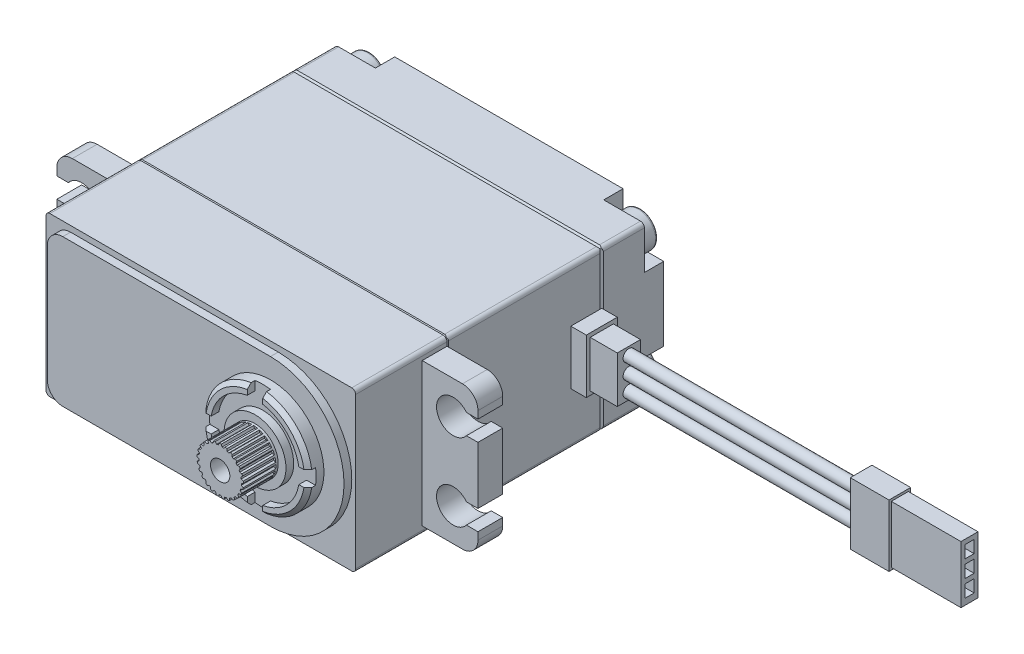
SolidWorks part; units mm, degrees
ref_plane "前视基准面" through (0, 0, 0) normal (0, 0, 1) x (1, 0, 0)
ref_plane "上视基准面" through (0, 0, 0) normal (0, 1, 0) x (1, 0, 0)
ref_plane "右视基准面" through (0, 0, 0) normal (1, 0, 0) x (0, 0, -1)
sketch "草图1" plane through (0, 0, 0) normal (0, 0, 1) x (1, 0, 0)
  line L1 (-20, 10.25) -> (20, 10.25)
  line L2 (-20, 10.25) -> (-20, -10.25)
  line L3 (-20, -10.25) -> (20, -10.25)
  line L4 (20, 10.25) -> (20, -10.25)
  dimension "D1" = 10.25
  dimension "D2" = 20.5
  dimension "D3" = 20
  dimension "D4" = 40
extrude "凸台-拉伸1" add sketch "草图1" along normal blind 8
chamfer "倒角1" distance 0.2 angle 45 4 edges at (0, 10.25, 8) (20, 0, 8) (0, -10.25, 8) (-20, 0, 8)
sketch "草图2" plane through (0, 0, 8) normal (0, 0, 1) x (1, 0, 0)
  line L0 (20, 10.25) -> (20, -10.25) construction
  line L1 (20, -10.25) -> (-20, -10.25) construction
  line L2 (-20, -10.25) -> (-20, 10.25) construction
  line L3 (-20, 10.25) -> (20, 10.25) construction
  line L4 (20, 10.25) -> (20, -10.25)
  line L5 (20, -10.25) -> (-20, -10.25)
  line L6 (-20, -10.25) -> (-20, 10.25)
  line L7 (-20, 10.25) -> (20, 10.25)
extrude "凸台-拉伸2" add sketch "草图2" along normal blind 20
chamfer "倒角4" distance 0.2 angle 45 4 edges at (-20, 0, 8) (0, 10.25, 8) (20, 0, 8) (0, -10.25, 8)
chamfer "倒角5" distance 0.2 angle 45 4 edges at (20, 0, 28) (0, -10.25, 28) (-20, 0, 28) (0, 10.25, 28)
sketch "草图3" plane through (0, 0, 28) normal (0, 0, 1) x (1, 0, 0)
  line L0 (20, 10.25) -> (20, -10.25) construction
  line L1 (20, -10.25) -> (-20, -10.25) construction
  line L2 (-20, -10.25) -> (-20, 10.25) construction
  line L3 (-20, 10.25) -> (20, 10.25) construction
  line L4 (20, 10.25) -> (20, -10.25)
  line L5 (20, -10.25) -> (-20, -10.25)
  line L6 (-20, -10.25) -> (-20, 10.25)
  line L7 (-20, 10.25) -> (20, 10.25)
extrude "凸台-拉伸3" add sketch "草图3" along normal blind 12.8
sketch "草图4" plane through (0, 0, 40.8) normal (0, 0, 1) x (1, 0, 0)
  line L0 (20, -10.25) -> (20, 10.25) construction
  circle A0 centre (10, 0) radius 6.9
  dimension "D1" = 10
  dimension "D2" = 13.8
extrude "凸台-拉伸4" add sketch "草图4" along normal blind 2
sketch "草图5" plane through (0, 0, 42.8) normal (0, 0, 1) x (1, 0, 0)
  circle A0 centre (10, 0) radius 3
  dimension "D1" = 6
extrude "凸台-拉伸5" add sketch "草图5" along normal blind 4.5
sketch "草图6" plane through (0, 0, 42.8) normal (0, 0, 1) x (1, 0, 0)
  circle A0 centre (10, 0) radius 4
  circle A1 centre (10, 0) radius 5.75
  dimension "D1" = 8
  dimension "D2" = 11.5
extrude "切除-拉伸1" cut sketch "草图6" against normal blind 1
sketch "草图7" plane through (0, 0, 41.8) normal (0, 0, 1) x (1, 0, 0)
  line L0 (11, 6.8272) -> (11, 5.6624)
  line L1 (3.1728, -1) -> (4.3376, -1)
  line L2 (3.1728, 1) -> (4.3376, 1)
  line L5 (9, 6.8272) -> (9, 5.6624)
  line L6 (16.8272, -1) -> (15.6624, -1)
  line L7 (16.8272, 1) -> (15.6624, 1)
  line L8 (9, -6.8272) -> (9, -5.6624)
  line L9 (11, -6.8272) -> (11, -5.6624)
  circle A0 centre (10, 0) radius 5.75 construction
  arc A1 (4.3376, 1) -> (4.3376, -1) centre (10, 0) ccw
  circle A2 centre (10, 0) radius 6.9 construction
  arc A3 (3.1728, 1) -> (3.1728, -1) centre (10, 0) ccw
  arc A6 (11, 5.6624) -> (9, 5.6624) centre (10, 0) ccw
  arc A7 (11, 6.8272) -> (9, 6.8272) centre (10, 0) ccw
  arc A8 (15.6624, -1) -> (15.6624, 1) centre (10, 0) ccw
  arc A9 (16.8272, -1) -> (16.8272, 1) centre (10, 0) ccw
  arc A10 (9, -5.6624) -> (11, -5.6624) centre (10, 0) ccw
  arc A11 (9, -6.8272) -> (11, -6.8272) centre (10, 0) ccw
  point P3 (0.7328, -1)
  point P4 (20.4054, -1)
  point P5 (0.7328, 1)
  point P6 (20.4054, 1)
  point P27 (10, 0)
  dimension "D1" = 4
extrude "切除-拉伸5" cut sketch "草图7" along normal blind 1
ref_plane "基准面1" through (0, 0, 28) normal (0, 0, 1) x (1, 0, 0)
sketch "草图8" plane through (0, 0, 28) normal (0, 0, 1) x (1, 0, 0)
  line L4 (-20, 10.25) -> (-20, -10.25) construction
  line L5 (-27.2, 9.25) -> (-27.2, 6.3)
  line L6 (20, -9.25) -> (27.2, -9.25)
  line L7 (-20, 9.25) -> (-20, -9.25)
  line L8 (-20, -9.25) -> (-27.2, -9.25)
  line L9 (-20, 9.25) -> (-27.2, 9.25)
  line L10 (27.2, -6.3) -> (27.2, -9.25)
  line L12 (25.7125, -6.3) -> (27.2, -6.3)
  line L13 (25.7125, -3.7) -> (27.2, -3.7)
  line L14 (-25.7125, 6.3) -> (-27.2, 6.3)
  line L15 (-25.7125, 3.7) -> (-27.2, 3.7)
  line L16 (-27.2, 3.7) -> (-27.2, -3.7)
  line L17 (27.2, 3.7) -> (27.2, -3.7)
  line L18 (-25.7125, -3.7) -> (-27.2, -3.7)
  line L19 (25.7125, 3.7) -> (27.2, 3.7)
  line L20 (-25.7125, -6.3) -> (-27.2, -6.3)
  line L21 (-27.2, -6.3) -> (-27.2, -9.25)
  line L22 (25.7125, 6.3) -> (27.2, 6.3)
  line L23 (27.2, 9.25) -> (27.2, 6.3)
  line L24 (20, 9.25) -> (20, -9.25)
  line L25 (20, 9.25) -> (27.2, 9.25)
  arc A0 (-25.7125, 3.7) -> (-25.7125, 6.3) centre (-24, 5) ccw
  arc A1 (-25.7125, -3.7) -> (-25.7125, -6.3) centre (-24, -5) cw
  arc A2 (25.7125, -3.7) -> (25.7125, -6.3) centre (24, -5) ccw
  arc A3 (25.7125, 3.7) -> (25.7125, 6.3) centre (24, 5) cw
  point P11 (-27.2, 10.25)
  point P12 (-27.2, -10.25)
  point P19 (-19.0859, 9.25)
  point P20 (-30.2671, 9.25)
  point P29 (-24, 6.3)
  point P31 (-29.7758, 6.3)
  point P32 (-24, 3.7)
  point P33 (-29.7758, 3.7)
  dimension "D5" = 4.3
extrude "凸台-拉伸6" add sketch "草图8" along normal blind 3.2
sketch "草图11" plane through (0, 0, 47.3) normal (0, 0, 1) x (1, 0, 0)
  circle A0 centre (10, 0) radius 1.25
  dimension "D1" = 2.5
extrude "切除-拉伸7" cut sketch "草图11" against normal blind 6
sketch "草图12" plane through (0, 0, 47.3) normal (0, 0, 1) x (1, 0, 0)
  line L1 (9.76, 2.7395) -> (9.88, 2.9976)
  line L2 (10.24, 2.7395) -> (10.12, 2.9976)
  line L3 (10.9137, 2.5938) -> (10.8617, 2.8736)
  line L4 (10.4488, 2.7131) -> (10.6292, 2.9333)
  line L5 (11.5301, 2.285) -> (11.5493, 2.569)
  line L6 (11.1095, 2.5163) -> (11.3389, 2.6846)
  line L7 (12.0503, 1.8327) -> (12.1395, 2.103)
  line L8 (11.7004, 2.1613) -> (11.9645, 2.2673)
  line L9 (12.4416, 1.2653) -> (12.5953, 1.5049)
  line L10 (12.1844, 1.6705) -> (12.4667, 1.7075)
  line L11 (12.6796, 0.6183) -> (12.888, 0.8122)
  line L12 (12.5313, 1.0748) -> (12.8138, 1.0404)
  line L13 (12.7492, -0.0675) -> (12.9992, 0.0685)
  line L14 (12.719, 0.4115) -> (12.9841, 0.308)
  line L15 (12.646, -0.7491) -> (12.922, -0.6796)
  line L16 (12.736, -0.2776) -> (12.967, -0.4438)
  line L17 (12.3766, -1.3836) -> (12.6612, -1.3849)
  line L18 (12.581, -0.9493) -> (12.7634, -1.1677)
  line L19 (11.9578, -1.9312) -> (12.2332, -2.0032)
  line L20 (12.2638, -1.5613) -> (12.3862, -1.8183)
  line L21 (11.4161, -2.3574) -> (11.6649, -2.4956)
  line L22 (11.8044, -2.0752) -> (11.859, -2.3546)
  line L23 (10.7853, -2.6355) -> (10.9919, -2.8313)
  line L24 (11.2316, -2.4588) -> (11.2151, -2.7429)
  line L25 (10.1052, -2.748) -> (10.2566, -2.989)
  line L26 (10.5815, -2.6878) -> (10.4948, -2.9589)
  line L27 (9.4185, -2.6878) -> (9.5052, -2.9589)
  line L28 (9.8948, -2.748) -> (9.7434, -2.989)
  line L29 (8.7684, -2.4588) -> (8.7849, -2.7429)
  line L30 (9.2147, -2.6355) -> (9.0081, -2.8313)
  line L31 (8.1956, -2.0752) -> (8.141, -2.3546)
  line L32 (8.5839, -2.3574) -> (8.3351, -2.4956)
  line L33 (7.7362, -1.5613) -> (7.6138, -1.8183)
  line L34 (8.0422, -1.9312) -> (7.7668, -2.0032)
  line L35 (7.419, -0.9493) -> (7.2366, -1.1677)
  line L36 (7.6234, -1.3836) -> (7.3388, -1.3849)
  line L37 (7.264, -0.2776) -> (7.033, -0.4438)
  line L38 (7.354, -0.7491) -> (7.078, -0.6796)
  line L39 (7.281, 0.4115) -> (7.0159, 0.308)
  line L40 (7.2508, -0.0675) -> (7.0008, 0.0685)
  line L41 (7.4687, 1.0748) -> (7.1862, 1.0404)
  line L42 (7.3204, 0.6183) -> (7.112, 0.8122)
  line L43 (7.8156, 1.6705) -> (7.5333, 1.7075)
  line L44 (7.5584, 1.2653) -> (7.4047, 1.5049)
  line L45 (8.2996, 2.1613) -> (8.0355, 2.2673)
  line L46 (7.9497, 1.8327) -> (7.8605, 2.103)
  line L47 (8.8905, 2.5163) -> (8.6611, 2.6846)
  line L48 (8.4699, 2.285) -> (8.4507, 2.569)
  line L49 (9.5512, 2.7131) -> (9.3708, 2.9333)
  line L50 (9.0863, 2.5938) -> (9.1383, 2.8736)
  arc A0 (9.76, 2.7395) -> (9.5512, 2.7131) centre (10, 0) ccw
  arc A1 (9.0863, 2.5938) -> (8.8905, 2.5163) centre (10, 0) ccw
  circle A2 centre (10, 0) radius 3 construction
  arc A3 (9.88, 2.9976) -> (9.3708, 2.9333) centre (10, 0) ccw
  arc A4 (9.1383, 2.8736) -> (8.6611, 2.6846) centre (10, 0) ccw
  arc A5 (8.4699, 2.285) -> (8.2996, 2.1613) centre (10, 0) ccw
  arc A6 (8.4507, 2.569) -> (8.0355, 2.2673) centre (10, 0) ccw
  arc A7 (7.9497, 1.8327) -> (7.8156, 1.6705) centre (10, 0) ccw
  arc A8 (7.8605, 2.103) -> (7.5333, 1.7075) centre (10, 0) ccw
  arc A9 (7.5584, 1.2653) -> (7.4687, 1.0748) centre (10, 0) ccw
  arc A10 (7.4047, 1.5049) -> (7.1862, 1.0404) centre (10, 0) ccw
  arc A11 (7.3204, 0.6183) -> (7.281, 0.4115) centre (10, 0) ccw
  arc A12 (7.112, 0.8122) -> (7.0159, 0.308) centre (10, 0) ccw
  arc A13 (7.2508, -0.0675) -> (7.264, -0.2776) centre (10, 0) ccw
  arc A14 (7.0008, 0.0685) -> (7.033, -0.4438) centre (10, 0) ccw
  arc A15 (7.354, -0.7491) -> (7.419, -0.9493) centre (10, 0) ccw
  arc A16 (7.078, -0.6796) -> (7.2366, -1.1677) centre (10, 0) ccw
  arc A17 (7.3388, -1.3849) -> (7.6138, -1.8183) centre (10, 0) ccw
  arc A18 (7.6234, -1.3836) -> (7.7362, -1.5613) centre (10, 0) ccw
  arc A19 (8.0422, -1.9312) -> (8.1956, -2.0752) centre (10, 0) ccw
  arc A20 (7.7668, -2.0032) -> (8.141, -2.3546) centre (10, 0) ccw
  arc A21 (8.5839, -2.3574) -> (8.7684, -2.4588) centre (10, 0) ccw
  arc A22 (8.3351, -2.4956) -> (8.7849, -2.7429) centre (10, 0) ccw
  arc A23 (9.2147, -2.6355) -> (9.4185, -2.6878) centre (10, 0) ccw
  arc A24 (9.0081, -2.8313) -> (9.5052, -2.9589) centre (10, 0) ccw
  arc A25 (9.8948, -2.748) -> (10.1052, -2.748) centre (10, 0) ccw
  arc A26 (9.7434, -2.989) -> (10.2566, -2.989) centre (10, 0) ccw
  arc A27 (10.5815, -2.6878) -> (10.7853, -2.6355) centre (10, 0) ccw
  arc A28 (10.4948, -2.9589) -> (10.9919, -2.8313) centre (10, 0) ccw
  arc A29 (11.2316, -2.4588) -> (11.4161, -2.3574) centre (10, 0) ccw
  arc A30 (11.2151, -2.7429) -> (11.6649, -2.4956) centre (10, 0) ccw
  arc A31 (11.8044, -2.0752) -> (11.9578, -1.9312) centre (10, 0) ccw
  arc A32 (11.859, -2.3546) -> (12.2332, -2.0032) centre (10, 0) ccw
  arc A33 (12.3862, -1.8183) -> (12.6612, -1.3849) centre (10, 0) ccw
  arc A34 (12.2638, -1.5613) -> (12.3766, -1.3836) centre (10, 0) ccw
  arc A35 (12.7634, -1.1677) -> (12.922, -0.6796) centre (10, 0) ccw
  arc A36 (12.581, -0.9493) -> (12.646, -0.7491) centre (10, 0) ccw
  arc A37 (12.967, -0.4438) -> (12.9992, 0.0685) centre (10, 0) ccw
  arc A38 (12.736, -0.2776) -> (12.7492, -0.0675) centre (10, 0) ccw
  arc A39 (12.9841, 0.308) -> (12.888, 0.8122) centre (10, 0) ccw
  arc A40 (12.719, 0.4115) -> (12.6796, 0.6183) centre (10, 0) ccw
  arc A41 (12.5313, 1.0748) -> (12.4416, 1.2653) centre (10, 0) ccw
  arc A42 (12.8138, 1.0404) -> (12.5953, 1.5049) centre (10, 0) ccw
  arc A43 (12.1844, 1.6705) -> (12.0503, 1.8327) centre (10, 0) ccw
  arc A44 (12.4667, 1.7075) -> (12.1395, 2.103) centre (10, 0) ccw
  arc A45 (11.7004, 2.1613) -> (11.5301, 2.285) centre (10, 0) ccw
  arc A46 (11.9645, 2.2673) -> (11.5493, 2.569) centre (10, 0) ccw
  arc A47 (11.1095, 2.5163) -> (10.9137, 2.5938) centre (10, 0) ccw
  arc A48 (11.3389, 2.6846) -> (10.8617, 2.8736) centre (10, 0) ccw
  arc A49 (10.4488, 2.7131) -> (10.24, 2.7395) centre (10, 0) ccw
  arc A50 (10.6292, 2.9333) -> (10.12, 2.9976) centre (10, 0) ccw
  point P111 (10, 0)
  dimension "D1" = 5.5
  dimension "D4" = 25
extrude "切除-拉伸8" cut sketch "草图12" against normal blind 4.2
sketch "草图13" plane through (0, 0, 40.8) normal (0, 0, 1) x (1, 0, 0)
  line L0 (10, 9.5) -> (-14, 9.5)
  line L1 (10, -9.5) -> (-14, -9.5)
  line L2 (20, -10.25) -> (20, 10.25) construction
  line L3 (-14, 9.5) -> (-18.8301, 9.5)
  line L4 (-18.8301, 9.5) -> (-18.8301, -9.5)
  line L5 (-20, -10.25) -> (20, -10.25) construction
  line L7 (-20, 10.25) -> (-20, -10.25) construction
  line L8 (20, 10.25) -> (-20, 10.25) construction
  line L9 (20, -10.25) -> (20, 10.25)
  line L10 (-20, -10.25) -> (20, -10.25)
  line L11 (-20, 10.25) -> (-20, -10.25)
  line L12 (20, 10.25) -> (-20, 10.25)
  line L13 (-14, -9.5) -> (-18.8301, -9.5)
  arc A0 (10, -9.5) -> (10, 9.5) centre (10, 0) ccw
  point P15 (-14, 10.25)
  point P16 (-14, -11.4768)
  dimension "D1" = 19
extrude "切除-拉伸9" cut sketch "草图13" against normal blind 1
fillet "圆角1" radius 2 4 edges at (27.2, 9.25, 29.6) (27.2, -9.25, 29.6) (-27.2, 9.25, 29.6) (-27.2, -9.25, 29.6)
sketch "草图17" plane through (20, 0, 0) normal (1, 0, 0) x (0, 0, -1)
  line L2 (-12, 3.5) -> (-8, 3.5)
  line L3 (-12, 3.5) -> (-12, -3.5)
  line L4 (-12, -3.5) -> (-8, -3.5)
  line L5 (-8, 3.5) -> (-8, -3.5)
  dimension "D2" = 7
  dimension "D3" = 3.5
  dimension "D4" = 4
extrude "凸台-拉伸8" add sketch "草图17" along normal blind 2
sketch "草图18" plane through (22, 0, 0) normal (1, 0, 0) x (0, 0, -1)
  line L8 (-11.5, 3) -> (-11.5, -3)
  line L9 (-11.5, -3) -> (-8.5, -3)
  line L10 (-8.5, -3) -> (-8.5, 3)
  line L11 (-8.5, 3) -> (-11.5, 3)
  line L12 (-11.5, 3) -> (-11.5, -3)
  line L13 (-11.5, -3) -> (-8.5, -3)
  line L14 (-8.5, -3) -> (-8.5, 3)
  line L15 (-8.5, 3) -> (-11.5, 3)
  dimension "D1" = 0.5
extrude "凸台-拉伸9" add sketch "草图18" along normal blind 3.5
sketch "草图19" plane through (25.5, 0, 0) normal (1, 0, 0) x (0, 0, -1)
  line L0 (-8.5, -3) -> (-8.5, 3) construction
  line L1 (-8.5, -3) -> (-8.5, 3) construction
  line L2 (-8.5, 3) -> (-11.5, 3) construction
  circle A0 centre (-10, 0) radius 0.75
  circle A1 centre (-10, 2) radius 0.75
  circle A2 centre (-10, -2) radius 0.75
  dimension "D1" = 1.5
  dimension "D2" = 1.5
  dimension "D3" = 1.5
  dimension "D4" = 1.5
  dimension "D5" = 1.5
  dimension "D6" = 1.5
  dimension "D7" = 1
  dimension "D8" = 2
  dimension "D9" = 2
extrude "凸台-拉伸10" add sketch "草图19" along normal blind 30
sketch "草图20" plane through (55.5, 0, 0) normal (1, 0, 0) x (0, 0, -1)
  line L1 (-11.4, 4) -> (-8.6, 4)
  line L2 (-11.4, 4) -> (-11.4, -4)
  line L3 (-11.4, -4) -> (-8.6, -4)
  line L4 (-8.6, 4) -> (-8.6, -4)
  circle A0 centre (-10, 2) radius 0.75 construction
  dimension "D1" = 8
  dimension "D2" = 2.8
  dimension "D3" = 1.4
  dimension "D4" = 4
extrude "凸台-拉伸11" add sketch "草图20" along normal blind 5
sketch "草图21" plane through (60.5, 0, 0) normal (1, 0, 0) x (0, 0, -1)
  line L5 (-10.59, 3.1) -> (-9.4, 3.1)
  line L6 (-10.59, 3.1) -> (-10.59, 1.5)
  line L7 (-10.59, 1.5) -> (-9.4, 1.5)
  line L8 (-11.1, 3.7) -> (-11.1, -3.7)
  line L9 (-11.1, -3.7) -> (-8.9, -3.7)
  line L10 (-8.9, -3.7) -> (-8.9, 3.7)
  line L11 (-8.9, 3.7) -> (-11.1, 3.7)
  line L12 (-11.1, 3.7) -> (-11.1, -3.7)
  line L13 (-11.1, -3.7) -> (-8.9, -3.7)
  line L14 (-8.9, -3.7) -> (-8.9, 3.7)
  line L15 (-8.9, 3.7) -> (-11.1, 3.7)
  line L16 (-9.4, 3.1) -> (-9.4, 1.5)
  line L17 (-10.59, 0.9) -> (-9.4, 0.9)
  line L18 (-10.59, 0.9) -> (-10.59, -0.7)
  line L19 (-10.59, -0.7) -> (-9.4, -0.7)
  line L20 (-9.4, 0.9) -> (-9.4, -0.7)
  line L21 (-10.59, -1.3) -> (-9.4, -1.3)
  line L22 (-10.59, -1.3) -> (-10.59, -2.9)
  line L23 (-10.59, -2.9) -> (-9.4, -2.9)
  line L24 (-9.4, -1.3) -> (-9.4, -2.9)
  dimension "D2" = 1.6
  dimension "D3" = 1.6
  dimension "D4" = 1.6
  dimension "D5" = 0.5
  dimension "D6" = 0.5
  dimension "D7" = 0.5
  dimension "D8" = 0.6
  dimension "D9" = 0.6
  dimension "D10" = 0.6
  dimension "D1" = 0.3
extrude "凸台-拉伸12" add sketch "草图21" along normal blind 9
sketch "草图22" plane through (0, 0, 0) normal (0, 0, -1) x (-1, 0, 0)
  line L5 (-20, 4.75) -> (-20, 10.25)
  line L6 (-20, 10.25) -> (-14.75, 10.25)
  line L7 (-17.5, -4.75) -> (-20, -4.75)
  line L8 (-14.75, -7.5) -> (-14.75, -10.25)
  line L9 (-20, -4.75) -> (-20, -10.25)
  line L11 (-20, -10.25) -> (-14.75, -10.25)
  line L12 (-14.75, 7.5) -> (-14.75, 10.25)
  line L13 (-17.5, 4.75) -> (-20, 4.75)
  line L14 (14.75, -7.5) -> (14.75, -10.25)
  line L15 (20, -10.25) -> (14.75, -10.25)
  line L16 (20, -4.75) -> (20, -10.25)
  line L17 (17.5, -4.75) -> (20, -4.75)
  line L18 (20, 4.75) -> (20, 10.25)
  line L19 (17.5, 4.75) -> (20, 4.75)
  line L20 (14.75, 7.5) -> (14.75, 10.25)
  line L21 (20, 10.25) -> (14.75, 10.25)
  arc A0 (-14.75, -7.5) -> (-17.5, -4.75) centre (-17.5, -7.5) ccw
  arc A1 (-14.75, 7.5) -> (-17.5, 4.75) centre (-17.5, 7.5) cw
  arc A2 (14.75, -7.5) -> (17.5, -4.75) centre (17.5, -7.5) cw
  arc A3 (14.75, 7.5) -> (17.5, 4.75) centre (17.5, 7.5) ccw
  dimension "D3" = 5.5
extrude "切除-拉伸13" cut sketch "草图22" against normal blind 2.5
sketch "草图23" plane through (0, 0, 2.5) normal (0, 0, -1) x (-1, 0, 0)
  line L4 (-17.25, -7.75) -> (-15.6165, -7.75)
  line L5 (-17.25, -7.25) -> (-15.6165, -7.25)
  line L6 (-17.25, 7.25) -> (-17.25, 5.6165)
  line L7 (-17.25, 7.75) -> (-15.6165, 7.75)
  line L8 (-17.25, -7.25) -> (-17.25, -5.6165)
  line L9 (-17.75, 7.25) -> (-17.75, 5.6165)
  line L10 (-17.75, -7.25) -> (-17.75, -5.6165)
  line L11 (-17.25, 7.25) -> (-15.6165, 7.25)
  line L12 (-19.3835, -7.25) -> (-17.75, -7.25)
  line L13 (-19.3835, -7.75) -> (-17.75, -7.75)
  line L14 (-17.75, -9.3835) -> (-17.75, -7.75)
  line L15 (-17.25, -9.3835) -> (-17.25, -7.75)
  line L16 (-19.3835, 7.25) -> (-17.75, 7.25)
  line L17 (-19.3835, 7.75) -> (-17.75, 7.75)
  line L18 (-17.25, 9.3835) -> (-17.25, 7.75)
  line L19 (-17.75, 9.3835) -> (-17.75, 7.75)
  line L20 (17.25, -7.25) -> (15.6165, -7.25)
  line L21 (17.25, -7.75) -> (15.6165, -7.75)
  line L22 (17.25, -9.3835) -> (17.25, -7.75)
  line L23 (17.75, -9.3835) -> (17.75, -7.75)
  line L24 (19.3835, -7.75) -> (17.75, -7.75)
  line L25 (19.3835, -7.25) -> (17.75, -7.25)
  line L26 (17.75, -7.25) -> (17.75, -5.6165)
  line L27 (17.25, -7.25) -> (17.25, -5.6165)
  line L28 (19.3835, 7.25) -> (17.75, 7.25)
  line L29 (17.75, 7.25) -> (17.75, 5.6165)
  line L30 (17.25, 7.25) -> (17.25, 5.6165)
  line L31 (17.25, 7.25) -> (15.6165, 7.25)
  line L32 (17.25, 7.75) -> (15.6165, 7.75)
  line L33 (17.25, 9.3835) -> (17.25, 7.75)
  line L34 (17.75, 9.3835) -> (17.75, 7.75)
  line L35 (19.3835, 7.75) -> (17.75, 7.75)
  circle A0 centre (-17.5, 7.5) radius 2.25
  arc A1 (-15.6165, 7.25) -> (-15.6165, 7.75) centre (-17.5, 7.5) ccw
  arc A2 (-17.75, 5.6165) -> (-17.25, 5.6165) centre (-17.5, 7.5) ccw
  arc A3 (-19.3835, 7.75) -> (-19.3835, 7.25) centre (-17.5, 7.5) ccw
  arc A4 (-17.25, 9.3835) -> (-17.75, 9.3835) centre (-17.5, 7.5) ccw
  arc A5 (-17.75, -5.6165) -> (-17.25, -5.6165) centre (-17.5, -7.5) cw
  arc A6 (-15.6165, -7.25) -> (-15.6165, -7.75) centre (-17.5, -7.5) cw
  arc A7 (-19.3835, -7.75) -> (-19.3835, -7.25) centre (-17.5, -7.5) cw
  arc A8 (-17.25, -9.3835) -> (-17.75, -9.3835) centre (-17.5, -7.5) cw
  circle A9 centre (-17.5, -7.5) radius 2.25
  arc A10 (15.6165, -7.25) -> (15.6165, -7.75) centre (17.5, -7.5) ccw
  arc A11 (17.25, -9.3835) -> (17.75, -9.3835) centre (17.5, -7.5) ccw
  arc A12 (19.3835, -7.75) -> (19.3835, -7.25) centre (17.5, -7.5) ccw
  arc A13 (17.75, -5.6165) -> (17.25, -5.6165) centre (17.5, -7.5) ccw
  circle A14 centre (17.5, -7.5) radius 2.25
  arc A15 (17.75, 5.6165) -> (17.25, 5.6165) centre (17.5, 7.5) cw
  arc A16 (19.3835, 7.75) -> (19.3835, 7.25) centre (17.5, 7.5) cw
  arc A17 (15.6165, 7.25) -> (15.6165, 7.75) centre (17.5, 7.5) cw
  arc A18 (17.25, 9.3835) -> (17.75, 9.3835) centre (17.5, 7.5) cw
  circle A19 centre (17.5, 7.5) radius 2.25
  point P8 (-19.75, 7.25)
  point P9 (-13.9428, 7.25)
  point P10 (-17.75, 9.75)
  point P11 (-17.75, 5.25)
  point P12 (-19.75, 7.75)
  point P13 (-13.9428, 7.75)
  point P14 (-17.25, 9.75)
  point P15 (-17.25, 5.25)
  dimension "D1" = 4.5
  dimension "D2" = 3.8
extrude "凸台-拉伸13" add sketch "草图23" along normal blind 2
fillet "圆角2" radius 0.3 4 edges at (-19.75, -7.5, 0.5) (19.75, -7.5, 0.5) (15.25, 7.5, 0.5) (-15.25, 7.5, 0.5)
fillet "圆角3" radius 2 2 edges at (-18.8301, 9.5, 40.3) (-18.8301, -9.5, 40.3)
chamfer "倒角6" distance 0.5 angle 45 4 edges at (5.121, 4.879, 42.8) (14.879, 4.879, 42.8) (14.879, -4.879, 42.8) (5.121, -4.879, 42.8)
fillet "圆角6" radius 0.5 4 edges at (20, 10.25, 33.9) (20, -10.25, 33.9) (-20, 10.25, 33.9) (-20, -10.25, 33.9)
fillet "圆角7" radius 0.5 4 edges at (20, -10.25, 18) (20, 10.25, 18) (-20, 10.25, 18) (-20, -10.25, 18)
fillet "圆角8" radius 0.5 4 edges at (20, 10.25, 5.15) (-20, 10.25, 5.15) (-20, -10.25, 5.15) (20, -10.25, 5.15)
